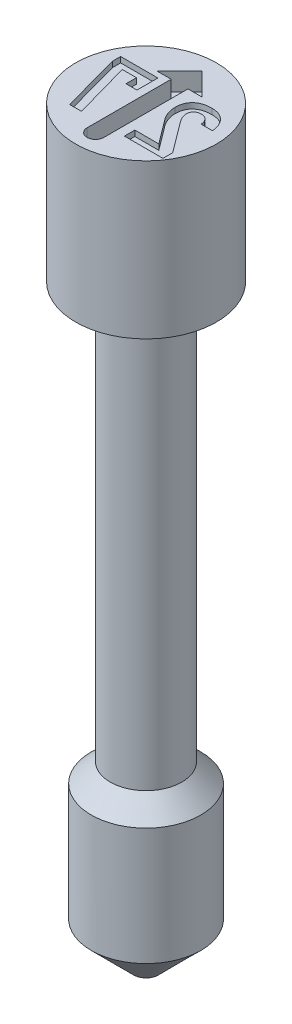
SolidWorks part; units mm, degrees
ref_plane "Front Plane" through (0, 0, 0) normal (0, 0, 1) x (1, 0, 0)
ref_plane "Top Plane" through (0, 0, 0) normal (0, 1, 0) x (1, 0, 0)
ref_plane "Right Plane" through (0, 0, 0) normal (1, 0, 0) x (0, 0, -1)
sketch "Sketch1" plane through (0, 0, 0) normal (0, 0, 1) x (1, 0, 0)
  line L0 (0, 17.018) -> (1.6002, 17.018)
  line L1 (0, -1.7602) -> (0, 1.7602) construction
  line L2 (1.6002, 17.018) -> (1.6002, 13.5128)
  line L3 (1.6002, 13.5128) -> (0.8128, 13.5128)
  line L4 (0.8128, 13.5128) -> (0.8128, 4.064)
  line L5 (0.8128, 4.064) -> (1.2446, 3.6322)
  line L6 (1.2446, 3.6322) -> (1.2446, 0.9652)
  line L7 (1.2446, 0.9652) -> (0.2794, 0)
  line L8 (1.7602, 0) -> (-1.7602, 0) construction
  line L9 (0.2794, 0) -> (0, 0)
  line L10 (0, 0) -> (0, 17.018)
  line L11 (0, 0) -> (0, 64.9194) construction
  dimension "D1" = 17.018
  dimension "D2" = 4.064
  dimension "D3" = 0.9652
  dimension "D4" = 45
  dimension "D5" = 2.4892
  dimension "D6" = 3.2004
  dimension "D7" = 1.6256
  dimension "D8" = 3.5052
revolve "Revolve1" add sketch "Sketch1" angle 360 about L11
sketch "Sketch2" plane through (0, 17.018, 0) normal (0, 1, 0) x (1, 0, 0)
  line L1 (0.1905, -1.1492) -> (0.1905, 0.762)
  line L2 (-0.1905, -1.1492) -> (-0.1905, 0.762)
  line L3 (0, -1.7602) -> (0, 1.7602) construction
  line L4 (-0.1905, 0.762) -> (-0.508, 0.762)
  line L5 (0.1905, 0.762) -> (0.508, 0.762)
  line L6 (0.508, 0.762) -> (0, 1.27)
  line L7 (0, 1.27) -> (-0.508, 0.762)
  line L8 (-1.7602, 0) -> (1.7602, 0) construction
  arc A0 (-0.1905, -1.1492) -> (0.1905, -1.1492) centre (0, -1.1492) ccw
  dimension "D6" = 1.1492
  dimension "D1" = 0.381
  dimension "D2" = 0.1905
  dimension "D3" = 1.016
  dimension "D4" = 0.508
  dimension "D5" = 45
  dimension "D7" = 0.762
extrude "Cut-Extrude1" cut sketch "Sketch2" against normal blind 0.4064
sketch "Sketch3" plane through (0, 17.018, 0) normal (0, 1, 0) x (1, 0, 0)
  text T0 "2 7" font "Bahnschrift SemiBold" height 1.524
  dimension "D1" = 0.889
extrude "Cut-Extrude2" cut sketch "Sketch3" against normal blind 0.127
